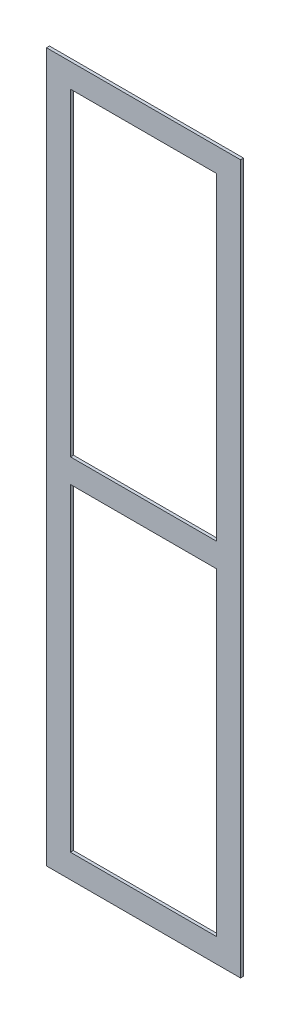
SolidWorks part; units mm, degrees
ref_plane "Front Plane" through (0, 0, 0) normal (0, 0, 1) x (1, 0, 0)
ref_plane "Top Plane" through (0, 0, 0) normal (0, 1, 0) x (1, 0, 0)
ref_plane "Right Plane" through (0, 0, 0) normal (1, 0, 0) x (0, 0, -1)
sketch "Sketch1" plane through (0, 0, 0) normal (0, 1, 0) x (1, 0, 0)
  line L0 (0, 50) -> (0, 41.5) construction
  line L1 (-50, 0) -> (-41.5, 0) construction
  line L2 (-50, 0) -> (-50, 50) construction
  line L3 (-50, 50) -> (50, 50) construction
  line L4 (50, 50) -> (50, -50) construction
  line L5 (50, -50) -> (-50, -50) construction
  line L6 (-50, -50) -> (-50, 0) construction
  line L7 (-41.5, 50) -> (-41.5, -50) construction
  line L8 (41.5, 50) -> (41.5, -50) construction
  line L9 (-50, 41.5) -> (50, 41.5) construction
  line L10 (-50, -41.5) -> (50, -41.5) construction
  line L11 (51.5875, 51.5875) -> (-51.5875, 51.5875)
  line L12 (50, 50) -> (-50, 50)
  line L13 (50, 50) -> (50, -50)
  line L14 (50, -50) -> (-50, -50)
  line L15 (-50, 50) -> (-50, -50)
  line L16 (-51.5875, 51.5875) -> (-51.5875, -51.5875)
  line L17 (51.5875, -51.5875) -> (-51.5875, -51.5875)
  line L18 (51.5875, 51.5875) -> (51.5875, -51.5875)
  line L47 (41.5, 0) -> (50, 0) construction
  line L52 (0, -41.5) -> (0, -50) construction
  circle A0 centre (0, 0) radius 76.2 construction
  dimension "D4" = 152.4
  dimension "D1" = 1.5875
extrude "BulkShellExtrude" add sketch "Sketch1" along normal blind 376.8
sketch "AirframeReferenceBottom" plane through (0, 0, 0) normal (0, 1, 0) x (1, 0, 0)
  circle A0 centre (0, 0) radius 76.2 construction
  dimension "D1" = 152.4
sketch "AxialReference" plane through (0, 0, 0) normal (1, 0, 0) x (0, 0, -1)
  line L0 (0, 0) -> (0, 376.8) construction
  line L1 (-51.5875, 376.8) -> (51.5875, 376.8) construction
sketch "AirframeReferenceTop" plane through (0, 376.8, 0) normal (0, 1, 0) x (1, 0, 0)
  circle A0 centre (0, 0) radius 76.2 construction
  dimension "D1" = 152.4
sketch "Sketch14" plane through (51.5875, 0, 0) normal (1, 0, 0) x (0, 0, -1)
  line L0 (-51.5875, 376.8) -> (-51.5875, 0) construction
  line L1 (-38.8875, 364.1) -> (38.8875, 364.1)
  line L2 (-38.8875, 364.1) -> (-38.8875, 12.7)
  line L3 (-38.8875, 12.7) -> (38.8875, 12.7)
  line L4 (38.8875, 364.1) -> (38.8875, 12.7)
  line L5 (51.5875, 376.8) -> (51.5875, 0) construction
  line L6 (76.2, 376.8) -> (-76.2, 376.8) construction
  line L7 (76.2, 0) -> (-76.2, 0) construction
  dimension "D1" = 12.7
  dimension "D2" = 12.7
  dimension "D3" = 12.7
  dimension "D4" = 12.7
extrude "SideWallCut" cut sketch "Sketch14" against normal blind 103.1875
pattern_circular "SideWallCutPattern" count 4 over 360 of "SideWallCut"
sketch "Sketch20" plane through (0, 0, 51.5875) normal (0, 0, 1) x (1, 0, 0)
  line L0 (-38.8875, 188.4) -> (38.8875, 188.4) construction
  line L1 (-38.8875, 364.1) -> (38.8875, 364.1) construction
  line L2 (-38.8875, 364.1) -> (-38.8875, 12.7) construction
  line L3 (-38.8875, 12.7) -> (38.8875, 12.7) construction
  line L4 (38.8875, 364.1) -> (38.8875, 12.7) construction
  line L5 (-38.8875, 182.05) -> (38.8875, 182.05)
  line L6 (-38.8875, 194.75) -> (38.8875, 194.75)
  line L8 (-38.8875, 194.75) -> (38.8875, 194.75)
  line L9 (-38.8875, 194.75) -> (-38.8875, 182.05)
  line L10 (-38.8875, 182.05) -> (38.8875, 182.05)
  line L11 (38.8875, 194.75) -> (38.8875, 182.05)
  dimension "D1" = 6.35
  dimension "D2" = 6.35
extrude "CenterSupport" add sketch "Sketch20" against normal blind 1.5875 contours L6 L5 M27 M29
pattern_circular "CenterSupportPatternCirc" count 4 over 360 about axis through (0, 0, 0) along (0, 1, 0) of "CenterSupport"
sketch "Sketch22" plane through (51.5875, 0, 0) normal (1, 0, 0) x (0, 0, -1)
  line L0 (76.2, 0) -> (-76.2, 0) construction
  line L1 (-51.5875, 376.8) -> (-50, 376.8) construction
  line L2 (-51.5875, 376.8) -> (-51.5875, 0) construction
  line L3 (-51.5875, 0) -> (-50, 0) construction
  line L4 (-50, 376.8) -> (-50, 0) construction
  line L5 (76.2, 376.8) -> (-76.2, 376.8) construction
  line L6 (51.5875, 0) -> (50, 0) construction
  line L7 (51.5875, 0) -> (51.5875, 376.8) construction
  line L8 (51.5875, 376.8) -> (50, 376.8) construction
  line L9 (50, 0) -> (50, 376.8) construction
  line L11 (-50, 376.8) -> (50, 376.8)
  line L12 (-50, 376.8) -> (-50, 0)
  line L13 (-50, 0) -> (50, 0)
  line L14 (50, 376.8) -> (50, 0)
  dimension "D1" = 1.5875
  dimension "D2" = 1.5875
extrude "Cut-Extrude4" cut sketch "Sketch22" against normal blind 103.1875
